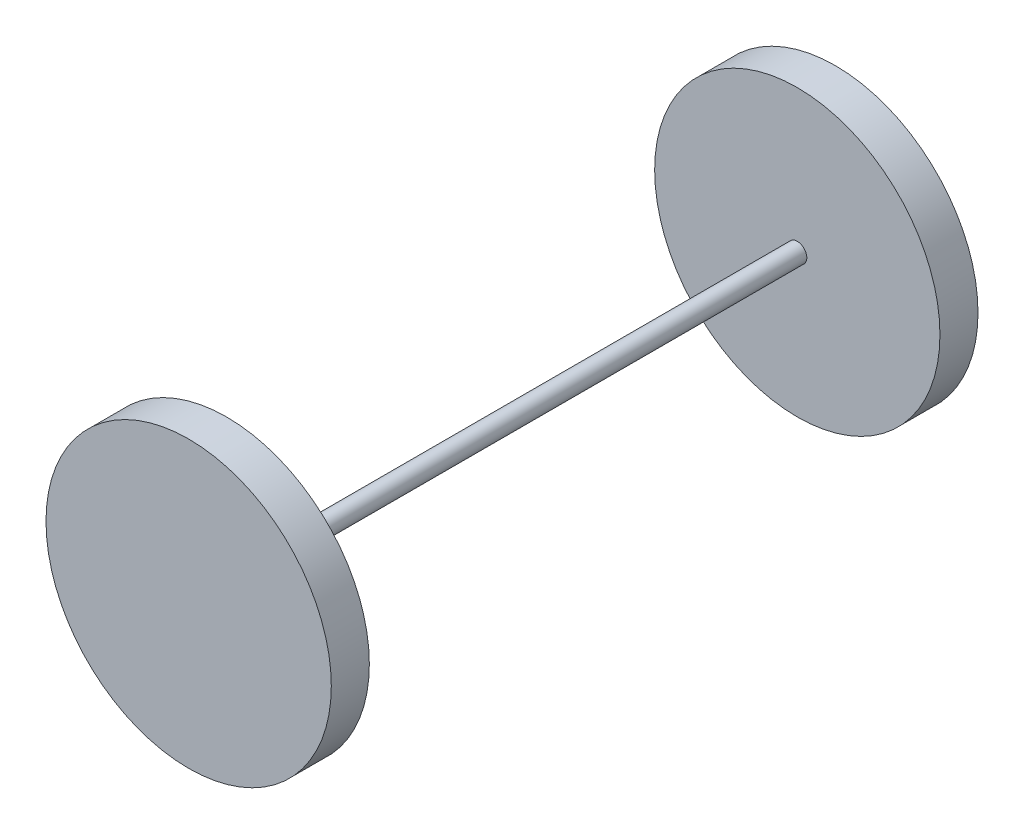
SolidWorks part; units mm, degrees
ref_plane "Plan de face" through (0, 0, 0) normal (0, 0, 1) x (1, 0, 0)
ref_plane "Plan de dessus" through (0, 0, 0) normal (0, 1, 0) x (1, 0, 0)
ref_plane "Plan de droite" through (0, 0, 0) normal (1, 0, 0) x (0, 0, -1)
sketch "Esquisse1" plane through (0, 0, 0) normal (0, 0, 1) x (1, 0, 0)
  circle A0 centre (0, 0) radius 75
  dimension "D1" = 150
extrude "Extrusion1" add sketch "Esquisse1" along normal blind 20
sketch "Esquisse2" plane through (0, 0, 20) normal (0, 0, 1) x (1, 0, 0)
  circle A0 centre (0, 0) radius 5
  dimension "D1" = 10
extrude "Extrusion2" add sketch "Esquisse2" along normal blind 300
sketch "Esquisse3" plane through (0, 0, 320) normal (0, 0, 1) x (1, 0, 0)
  circle A0 centre (0, 0) radius 75
  dimension "D1" = 150
extrude "Extrusion3" add sketch "Esquisse3" along normal blind 20
